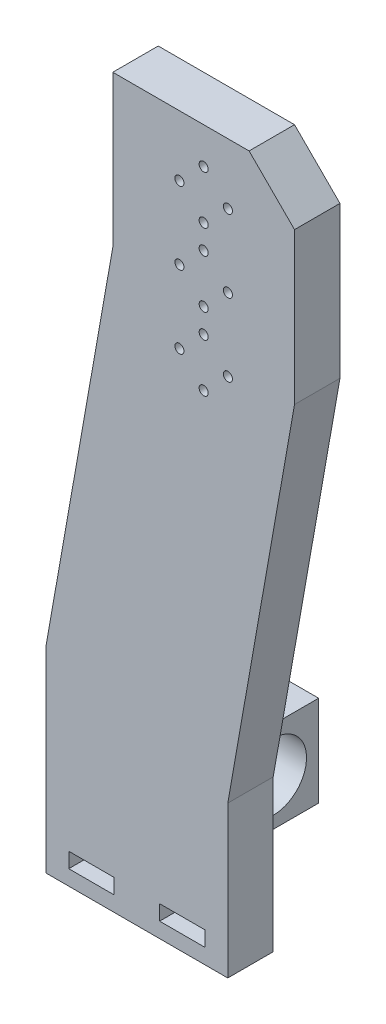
SolidWorks part; units mm, degrees
ref_plane "Alzado" through (0, 0, 0) normal (0, 0, 1) x (1, 0, 0)
ref_plane "Planta" through (0, 0, 0) normal (0, 1, 0) x (1, 0, 0)
ref_plane "Vista lateral" through (0, 0, 0) normal (1, 0, 0) x (0, 0, -1)
sketch "Croquis1" plane through (0, 0, 0) normal (0, 0, 1) x (1, 0, 0)
  line L0 (0, 0) -> (60, 0)
  line L1 (60, 0) -> (60, 50)
  line L2 (60, 50) -> (82.0409, 175)
  line L3 (82.0409, 175) -> (82.0409, 225)
  line L4 (82.0409, 225) -> (67.0409, 240)
  line L5 (67.0409, 240) -> (22.0409, 240)
  line L6 (22.0409, 240) -> (22.0409, 190)
  line L7 (22.0409, 190) -> (0, 65)
  line L8 (0, 65) -> (0, 0)
  line L9 (20.2891, 208) -> (91.3008, 208) construction
  line L10 (17.29, 184) -> (92.9559, 184) construction
  line L11 (30, -1.9057) -> (30, 26.7607) construction
  line L12 (7.5, 10) -> (22.5, 10)
  line L13 (7.5, 10) -> (7.5, 5)
  line L14 (7.5, 5) -> (22.5, 5)
  line L15 (22.5, 10) -> (22.5, 5)
  line L16 (37.5, 10) -> (37.5, 5)
  line L17 (52.5, 5) -> (37.5, 5)
  line L18 (52.5, 10) -> (52.5, 5)
  line L19 (52.5, 10) -> (37.5, 10)
  circle A0 centre (44.0409, 220) radius 1.5
  circle A6 centre (52.0409, 220) radius 8 construction
  circle A7 centre (52.0409, 228) radius 1.5
  circle A8 centre (60.0409, 220) radius 1.5
  circle A9 centre (52.0409, 212) radius 1.5
  circle A10 centre (52.0409, 204) radius 1.5
  circle A11 centre (60.0409, 196) radius 1.5
  circle A12 centre (52.0409, 188) radius 1.5
  circle A13 centre (44.0409, 196) radius 1.5
  circle A14 centre (44.0409, 172) radius 1.5
  circle A15 centre (52.0409, 180) radius 1.5
  circle A16 centre (60.0409, 172) radius 1.5
  circle A17 centre (52.0409, 164) radius 1.5
  point P19 (53.7491, 223.4008)
  point P37 (52.0409, 220)
  dimension "D11" = 3
  dimension "D12" = 20
  dimension "D18" = 8
  dimension "D14" = 16
  dimension "D1" = 240
  dimension "D2" = 60
  dimension "D3" = 170
  dimension "D4" = 50
  dimension "D5" = 50
  dimension "D6" = 45
  dimension "D7" = 50
  dimension "D8" = 65
  dimension "D9" = 170
  dimension "D10" = 15
  dimension "D13" = 30
  dimension "D15" = 4
  dimension "D16" = 20
  dimension "D17" = 12
  dimension "D19" = 15
  dimension "D20" = 5
  dimension "D21" = 7.5
  dimension "D22" = 5
  dimension "D23" = 30
  dimension "D24" = 8
  dimension "D25" = 12
extrude "Saliente-Extruir1" add sketch "Croquis1" along normal blind 15
sketch "Croquis2" plane through (0, 0, 0) normal (0, 0, -1) x (-1, 0, 0)
  line L0 (-60, 0) -> (-60, 50) construction
  line L1 (-45, 50) -> (-15, 50)
  line L2 (-45, 50) -> (-45, 20)
  line L3 (-45, 20) -> (-15, 20)
  line L4 (-15, 50) -> (-15, 20)
  line L5 (0, 0) -> (-60, 0) construction
  dimension "D1" = 30
  dimension "D2" = 30
  dimension "D3" = 15
  dimension "D4" = 20
extrude "Saliente-Extruir2" add sketch "Croquis2" along normal blind 30
sketch "Croquis3" plane through (15, 0, 0) normal (-1, 0, 0) x (0, 0, 1)
  line L0 (-30, 50) -> (0, 50) construction
  line L1 (-30, 20) -> (-30, 50) construction
  circle A0 centre (-15, 35) radius 11
  dimension "D1" = 22
  dimension "D2" = 15
  dimension "D3" = 15
extrude "Cortar-Extruir1" cut sketch "Croquis3" against normal blind 50
